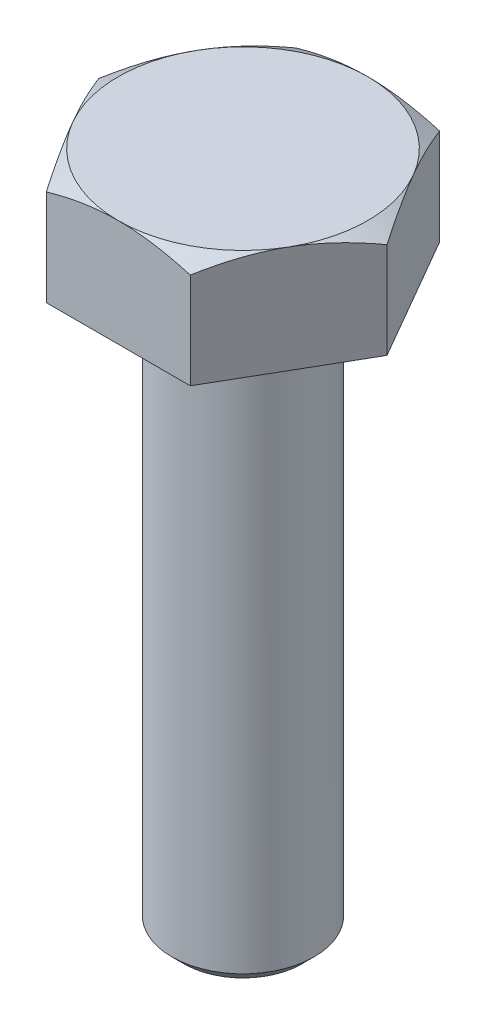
SolidWorks part; units mm, degrees
ref_plane "Front Plane" through (0, 0, 0) normal (0, 0, 1) x (1, 0, 0)
ref_plane "Top Plane" through (0, 0, 0) normal (0, 1, 0) x (1, 0, 0)
ref_plane "Right Plane" through (0, 0, 0) normal (1, 0, 0) x (0, 0, -1)
sketch "Sketch1" plane through (0, 0, 0) normal (0, 1, 0) x (1, 0, 0)
  line L1 (6.4231, 0) -> (3.2116, 5.5626)
  line L2 (3.2116, 5.5626) -> (-3.2116, 5.5626)
  line L3 (-3.2116, 5.5626) -> (-6.4231, 0)
  line L4 (-6.4231, 0) -> (-3.2116, -5.5626)
  line L5 (-3.2116, -5.5626) -> (3.2116, -5.5626)
  line L6 (3.2116, -5.5626) -> (6.4231, 0)
  circle A0 centre (0, 0) radius 5.5626 construction
  dimension "D1" = 11.1252
extrude "Boss-Extrude1" add sketch "Sketch1" along normal blind 4.7752
sketch "Sketch2" plane through (0, 4.7752, 0) normal (0, 1, 0) x (1, 0, 0)
  line L0 (-6.4231, 0) -> (-3.2116, -5.5626) construction
  circle A0 centre (0, 0) radius 5.5626
extrude "Cut-Extrude1" cut sketch "Sketch2" against normal blind 4.7752 draft 60 flip side to cut
sketch "Sketch3" plane through (0, 0, 0) normal (0, -1, 0) x (1, 0, 0)
  circle A0 centre (0, 0) radius 3.175
  dimension "D1" = 6.35
extrude "Boss-Extrude2" add sketch "Sketch3" along normal blind 25.4
sketch "Sketch4" plane through (0, -25.4, 0) normal (0, -1, 0) x (1, 0, 0)
  circle A0 centre (0, 0) radius 2.6339
extrude "Cut-Extrude2" cut sketch "Sketch4" against normal blind 25.4 draft 45 flip side to cut
